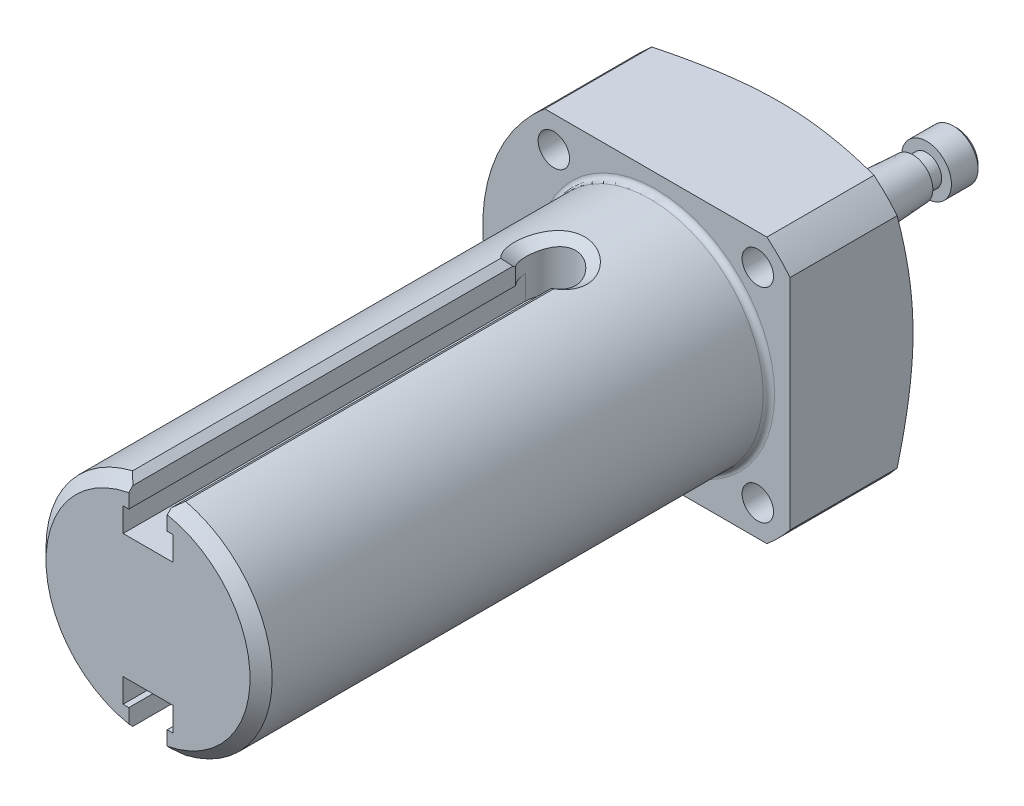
SolidWorks part; units mm, degrees
ref_plane "Front Plane" through (0, 0, 0) normal (0, 0, 1) x (1, 0, 0)
ref_plane "Top Plane" through (0, 0, 0) normal (0, 1, 0) x (1, 0, 0)
ref_plane "Right Plane" through (0, 0, 0) normal (1, 0, 0) x (0, 0, -1)
sketch "Sketch1" plane through (0, 0, 0) normal (0, 0, 1) x (1, 0, 0)
  line L0 (0, 0) -> (62.0084, 0) construction
  line L1 (-15.2811, 18.2626) -> (15.2811, 18.2626)
  line L2 (18.4658, 15.0349) -> (18.4658, -15.0349)
  line L3 (-15.2811, -18.2626) -> (15.2811, -18.2626)
  arc A0 (-15.2811, 18.2626) -> (-15.2811, -18.2626) centre (0, 0) ccw
  arc A1 (18.4658, 15.0349) -> (15.2811, 18.2626) centre (0, 0) ccw
  arc A2 (15.2811, -18.2626) -> (18.4658, -15.0349) centre (0, 0) ccw
  dimension "D1" = 47.625
  dimension "D2" = 36.5252
  dimension "D3" = 18.4658
extrude "Extrude1" add sketch "Sketch1" along normal blind 91.186
sketch "Sketch2" plane through (0, 0, 0) normal (0, 1, 0) x (1, 0, 0)
  line L0 (0, 0) -> (0, -96.9332) construction
  line L1 (-23.8125, -21.336) -> (-15.5575, -21.336)
  line L2 (-23.8125, 0) -> (-23.8125, -91.186) construction
  line L3 (-15.5575, -21.336) -> (-15.5575, -91.186)
  line L5 (-7.62, 0) -> (-23.8125, -6.604)
  line L6 (15.2811, 0) -> (-15.2811, 0) construction
  line L7 (-15.5575, -91.186) -> (-23.8125, -91.186)
  line L8 (-23.8125, -91.186) -> (-23.8125, -21.336)
  line L9 (-23.8125, -6.604) -> (-23.8125, 0)
  line L10 (-15.2811, 0) -> (-23.8125, 0) construction
  line L11 (-23.8125, 0) -> (-7.62, 0)
  dimension "D1" = 69.85
  dimension "D2" = 31.115
  dimension "D5" = 15.24
  dimension "D6" = 6.604
revolve "Cut-Revolve1" cut sketch "Sketch2" angle 360 about L0
sketch "Sketch4" plane through (0, 0, 0) normal (0, 1, 0) x (1, 0, 0)
  line L0 (0, 0) -> (0, -99.9671) construction
  line L1 (3.1686, 0) -> (3.1686, 7.366)
  line L2 (7.62, 0) -> (-7.62, 0) construction
  line L3 (3.1686, 7.366) -> (2.7622, 14.0106)
  line L4 (2.7622, 14.0106) -> (0, 14.0106)
  line L5 (-15.2811, -21.336) -> (15.2811, -21.336) construction
  line L7 (0, 14.0106) -> (0, 0)
  line L8 (0, 0) -> (3.1686, 0)
  dimension "D1" = 3.5
  dimension "D2" = 28.702
  dimension "D4" = 6.3373
  dimension "D5" = 5.5245
  dimension "D6" = 6.6446
revolve "Revolve1" add sketch "Sketch4" angle 360 about L0
hole_wizard "Hole1" positions "Sketch6" profile "Sketch5" legacy
sketch "Sketch6" plane through (0, 0, -14.0106) normal (0, 0, -1) x (-1, 0, 0)
  circle A0 centre (0, 0) radius 2.7622 construction
  point P0 (0, 0)
sketch "Sketch5" plane through (0, 0, -14.0106) normal (1, 0, 0) x (0, 1, 0)
  line L0 (0, 0) -> (0, 20.0878)
  line L1 (0, 20.0878) -> (1.7272, 19.05)
  line L2 (1.7272, 19.05) -> (1.7272, 0)
  line L4 (1.7272, 0) -> (0, 0)
  line L6 (0, 20.0878) -> (-1.7272, 19.05) construction
  line L7 (0, -4.2442) -> (0, 117.3081) construction
  dimension "Diameter" = 3.4544
  dimension "Depth" = 19.05
  dimension "Drill Angle" = 118
hole_wizard "Hole2" positions "Sketch10" profile "Sketch9" legacy
sketch "Sketch10" plane through (4.4648, 0.3939, 0) normal (0, 0, 1) x (1, 0, 0)
  line L1 (-4.4648, -0.3939) -> (19.5659, -0.3939) construction
  line L2 (-4.4648, -0.3939) -> (9.5623, 13.6333) construction
  circle A0 centre (-4.4648, -0.3939) radius 19.8374 construction
  point P0 (9.5623, 13.6333)
  dimension "D2" = 39.6748
  dimension "D1" = 45
sketch "Sketch9" plane through (14.0272, 14.0272, 0) normal (1, 0, 0) x (0, 1, 0)
  line L0 (0, 0) -> (0, 21.337)
  line L1 (0, 21.337) -> (2.159, 21.337)
  line L2 (2.159, 21.337) -> (2.159, 10.1092)
  line L3 (2.159, 10.1092) -> (3.5687, 10.1092)
  line L4 (3.5687, 10.1092) -> (3.5687, 0)
  line L5 (3.5687, 0) -> (0, 0)
  line L6 (0, 110) -> (0, -10) construction
  dimension "Diameter" = 4.318
  dimension "Depth" = 21.337
  dimension "C-Bore Diameter" = 7.1374
  dimension "C-Bore Depth" = 10.1092
pattern_circular "CirPattern1" count 4 over 360 about axis through (0, 0, 0) along (0, 0, 1) of "Hole2"
ref_plane "Plane1" through (0, 0, 13.4112) normal (0, 0, 1) x (1, 0, 0)
sketch "Sketch11" plane through (0, 0, 13.4112) normal (0, 0, 1) x (1, 0, 0)
  line L0 (0, 0) -> (19.9355, -8.4621) construction
  line L1 (0, 0) -> (27.0444, 0) construction
  line L2 (-61.6111, 21.627) -> (-14.8495, 1.7779)
  line L3 (-14.8495, 1.7779) -> (-13.2219, 5.6123)
  line L4 (-13.2219, 5.6123) -> (-59.9835, 25.4615)
  line L5 (-59.9835, 25.4615) -> (-61.6111, 21.627)
  dimension "D1" = 23
  dimension "D2" = 14.3637
  dimension "D3" = 8.3312
  dimension "D4" = 50.8
revolve "Cut-Revolve2" cut sketch "Sketch11" angle 360 about L0
mirror "Mirror1" about plane through (0, 0, 0) normal (0, 1, 0) of "Cut-Revolve2"
sketch "Sketch12" plane through (0, 0, 91.186) normal (0, 0, 1) x (1, 0, 0)
  line L0 (0, 0) -> (0, 26.7352) construction
  line L1 (-2.6416, 50.8) -> (-2.6416, 11.8237)
  line L2 (-2.6416, 11.8237) -> (-3.429, 11.8237)
  line L3 (-3.429, 11.8237) -> (-3.429, 8.5217)
  line L4 (-3.429, 8.5217) -> (3.429, 8.5217)
  line L5 (3.429, 11.8237) -> (3.429, 8.5217)
  line L6 (2.6416, 11.8237) -> (3.429, 11.8237)
  line L7 (2.6416, 50.8) -> (2.6416, 11.8237)
  line L8 (-2.6416, 50.8) -> (2.6416, 50.8)
  dimension "D1" = 5.2832
  dimension "D2" = 6.858
  dimension "D3" = 3.302
  dimension "D4" = 8.5217
  dimension "D5" = 50.8
extrude "Cut-Extrude1" cut sketch "Sketch12" against normal blind 55.372
sketch "Sketch13" plane through (0, 0, 91.186) normal (0, 0, 1) x (1, 0, 0)
  line L0 (0, 0) -> (32.0428, 0) construction
  line L1 (0, 0) -> (0, -27.5102) construction
  line L2 (-3.429, -8.5217) -> (3.429, -8.5217)
  line L3 (3.429, -8.5217) -> (3.429, -11.8237)
  line L4 (3.429, -11.8237) -> (2.6416, -11.8237)
  line L5 (2.6416, -11.8237) -> (2.6416, -50.8)
  line L6 (2.6416, -50.8) -> (-2.6416, -50.8)
  line L7 (-3.429, 8.5217) -> (3.429, 8.5217) construction
  line L8 (3.429, 11.8237) -> (3.429, 8.5217) construction
  line L9 (2.6416, 50.8) -> (2.6416, 11.8237) construction
  line L10 (-2.6416, -11.8237) -> (-2.6416, -50.8)
  line L11 (-3.429, -11.8237) -> (-2.6416, -11.8237)
  line L12 (-3.429, -8.5217) -> (-3.429, -11.8237)
extrude "Cut-Extrude2" cut sketch "Sketch13" against normal blind 39.624
sketch "Sketch14" plane through (0, 18.2626, 0) normal (0, 1, 0) x (1, 0, 0)
  line L0 (-2.6416, -35.814) -> (2.6416, -35.814) construction
  circle A0 centre (0, -35.814) radius 3.429
  dimension "D1" = 3.429
extrude "Cut-Extrude3" cut sketch "Sketch14" against normal up to surface (9.7409 mm away)
sketch "Sketch15" plane through (0, -18.2626, 0) normal (0, -1, 0) x (1, 0, 0)
  line L0 (3.429, 51.562) -> (-3.429, 51.562) construction
  circle A0 centre (0, 51.562) radius 3.429
  dimension "D1" = 3.429
extrude "Cut-Extrude4" cut sketch "Sketch15" against normal up to surface (9.7409 mm away)
sketch "Sketch16" plane through (0, 0, 0) normal (0, 1, 0) x (1, 0, 0)
  line L0 (0, 0) -> (0, -122.9241) construction
  line L1 (2.0828, 14.0106) -> (2.0828, 15.9004)
  line L2 (2.7622, 14.0106) -> (-2.7622, 14.0106) construction
  line L3 (2.0828, 15.9004) -> (3.429, 15.9004)
  line L4 (3.429, 15.9004) -> (3.429, 19.558)
  line L5 (3.429, 19.558) -> (2.921, 20.066)
  line L6 (2.921, 20.066) -> (0, 20.066)
  line L7 (0, 20.066) -> (0, 14.0106)
  line L8 (0, 14.0106) -> (2.0828, 14.0106)
  line L9 (-3.1686, 7.366) -> (3.1686, 7.366) construction
  dimension "D1" = 4.1656
  dimension "D2" = 8.5344
  dimension "D3" = 6.858
  dimension "D4" = 4.1656
  dimension "D5" = 45
  dimension "D6" = 5.842
revolve "Revolve2" add sketch "Sketch16" angle 360 about L0
sketch "Sketch17" plane through (0, 0, -20.066) normal (0, 0, -1) x (-1, 0, 0)
  line L1 (1.7859, -1.0311) -> (1.7859, 1.0311)
  line L2 (1.7859, 1.0311) -> (0, 2.0622)
  line L3 (0, 2.0622) -> (-1.7859, 1.0311)
  line L4 (-1.7859, 1.0311) -> (-1.7859, -1.0311)
  line L5 (-1.7859, -1.0311) -> (0, -2.0622)
  line L6 (0, -2.0622) -> (1.7859, -1.0311)
  circle A0 centre (0, 0) radius 1.7859 construction
  dimension "D1" = 3.5719
extrude "Cut-Extrude5" cut sketch "Sketch17" against normal blind 3.175
chamfer "Chamfer1" distance 1.524 angle 45 2 edges at (-15.5575, 0, 91.186) (15.5575, 0, 91.186)
fillet "Fillet1" radius 0.7874 1 edges at (-15.5575, 0, 21.336)
chamfer "Chamfer2" distance 0.9906 angle 51.75 6 edges at (2.6416, -15.3316, 71.7052) (-0.4408, -15.5513, 54.9625) (-2.6416, -15.3316, 71.7052) (-2.6416, 15.3316, 63.8312) (-0.4408, 15.5513, 32.4135) (2.6416, 15.3316, 63.8312)
